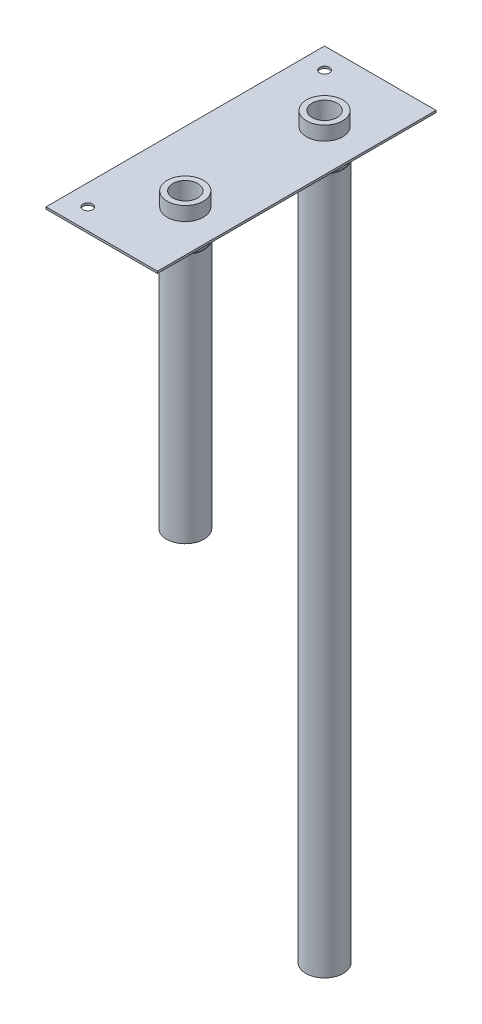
SolidWorks part; units mm, degrees
ref_plane "Plan1" through (0, 0, 0) normal (0, 0, 1) x (1, 0, 0)
ref_plane "Plan2" through (0, 0, 0) normal (0, 1, 0) x (1, 0, 0)
ref_plane "Plan3" through (0, 0, 0) normal (1, 0, 0) x (0, 0, -1)
sketch "Esquisse1" plane through (0, 0, 0) normal (0, 0, 1) x (1, 0, 0)
  line L0 (0, 0) -> (80, 0)
  line L1 (0, 0) -> (0, -1.5)
  line L4 (0, -1.5) -> (80, -1.5)
  line L5 (80, -1.5) -> (80, 0)
  dimension "D1" = 80
  dimension "D3" = 1.5
extrude "Extrusion1" add sketch "Esquisse1" against normal blind 200
sketch "Esquisse2" plane through (0, 0, 0) normal (0, 1, 0) x (-1, 0, 0)
  line L0 (0, -200) -> (0, 0) construction
  line L1 (-80, 0) -> (0, 0) construction
  line L2 (-80, -200) -> (0, -200) construction
  circle A0 centre (-50, -50) radius 13
  circle A1 centre (-50, -150) radius 13
  circle A2 centre (-15, -15) radius 3.5
  circle A3 centre (-15, -185) radius 3.5
  dimension "D4" = 26
  dimension "D5" = 7
  dimension "D6" = 15
  dimension "D7" = 15
  dimension "D9" = 170
  dimension "D1" = 50
  dimension "D2" = 50
  dimension "D3" = 100
  dimension "D8" = 15
extrude "Enlèv. mat.-Extru.1" cut sketch "Esquisse2" against normal up to next
sketch "Esquisse3" plane through (0, 0, 0) normal (0, 1, 0) x (-1, 0, 0)
  circle A0 centre (-50, -50) radius 13
  circle A1 centre (-50, -50) radius 9
  circle A2 centre (-50, -50) radius 13 construction
  circle A3 centre (-50, -150) radius 9
  circle A4 centre (-50, -150) radius 13
  circle A5 centre (-50, -150) radius 13 construction
  dimension "D1" = 26
  dimension "D2" = 18
  dimension "D3" = 18
  dimension "D4" = 26
extrude "Extrusion2" add sketch "Esquisse3" against normal blind 20 and the other way blind 10
sketch "Esquisse4" plane through (0, -20, 0) normal (0, -1, 0) x (1, 0, 0)
  circle A0 centre (50, -50) radius 13.45
  circle A1 centre (50, -50) radius 10.85
  dimension "D1" = 26.9
  dimension "D2" = 2.6
extrude "Extrusion3" add sketch "Esquisse4" along normal blind 180
sketch "Esquisse5" plane through (0, -20, 0) normal (0, -1, 0) x (1, 0, 0)
  circle A0 centre (50, -150) radius 13.45
  circle A1 centre (50, -150) radius 10.85
  dimension "D1" = 26.9
  dimension "D2" = 2.6
extrude "Extrusion4" add sketch "Esquisse5" along normal blind 500
